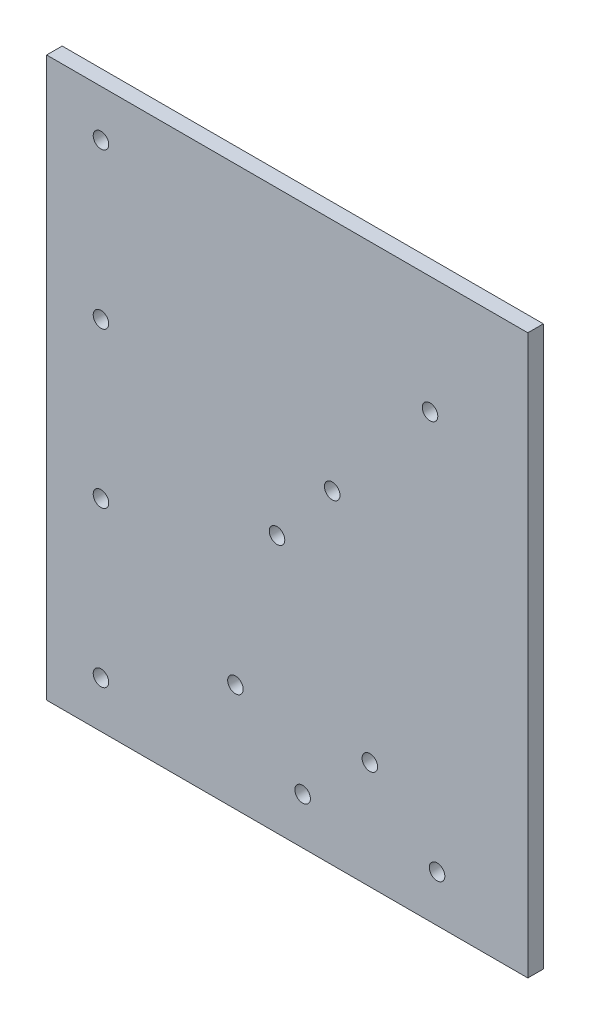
SolidWorks part; units mm, degrees
ref_plane "Front Plane" through (0, 0, 0) normal (0, 0, 1) x (1, 0, 0)
ref_plane "Top Plane" through (0, 0, 0) normal (0, 1, 0) x (1, 0, 0)
ref_plane "Right Plane" through (0, 0, 0) normal (1, 0, 0) x (0, 0, -1)
sketch "Sketch1" plane through (0, 0, 0) normal (0, 0, 1) x (1, 0, 0)
  line L1 (0, 0) -> (393.7, 0)
  line L2 (0, 0) -> (0, 457.2)
  line L3 (0, 457.2) -> (393.7, 457.2)
  line L4 (393.7, 0) -> (393.7, 457.2)
  dimension "D1" = 393.7
  dimension "D2" = 457.2
extrude "Plate" add sketch "Sketch1" along normal blind 12.7
hole_wizard "Hole" positions "Sketch4" profile "Sketch3" hole size "1/2" standard "Ansi Inch"
sketch "Sketch4" plane through (0, 0, 12.7) normal (0, 0, 1) x (1, 0, 0)
  line L0 (0, 457.2) -> (0, 0) construction
  line L1 (0, 0) -> (393.7, 0) construction
  point P0 (44.45, 38.1)
  dimension "D1" = 44.45
  dimension "D2" = 38.1
sketch "Sketch3" plane through (44.45, 38.1, 12.7) normal (1, 0, 0) x (0, -1, 0)
  line L0 (0, 0) -> (0, 29.2155)
  line L1 (0, 29.2155) -> (6.35, 25.4)
  line L2 (6.35, 25.4) -> (6.35, 0)
  line L5 (6.35, 0) -> (0, 0)
  line L10 (0, 29.2155) -> (-6.35, 25.4) construction
  line L11 (0, -6.35) -> (0, 107.95) construction
  dimension "Hole Dia." = 12.7
  dimension "Hole Depth" = 25.4
  dimension "Drill Angle" = 118
pattern_linear "Standard Linear" count 4 spacing 127 along (0, 1, 0) of "Hole"
sketch "Sketch5" plane through (0, 0, 12.7) normal (0, 0, 1) x (1, 0, 0)
  line L0 (44.45, 38.1) -> (393.7, 457.2) construction
  point P4 (313.677, 361.1723)
  point P5 (233.6539, 265.1447)
  point P6 (188.4915, 210.9498)
  dimension "D1" = 125
  dimension "D2" = 125
  dimension "D3" = 225
pattern_sketch "Sketch-Pattern1" of "Hole"
sketch "Sketch6" plane through (0, 0, 12.7) normal (0, 0, 1) x (1, 0, 0)
  point P0 (154.45, 88.1)
  point P1 (264.45, 88.1)
  point P2 (209.45, 38.1)
  point P3 (319.45, 38.1)
  dimension "D1" = 110
  dimension "D2" = 165
  dimension "D3" = 220
  dimension "D4" = 275
  dimension "D6" = 50
pattern_sketch "Sketch-Pattern2" of "Hole"
